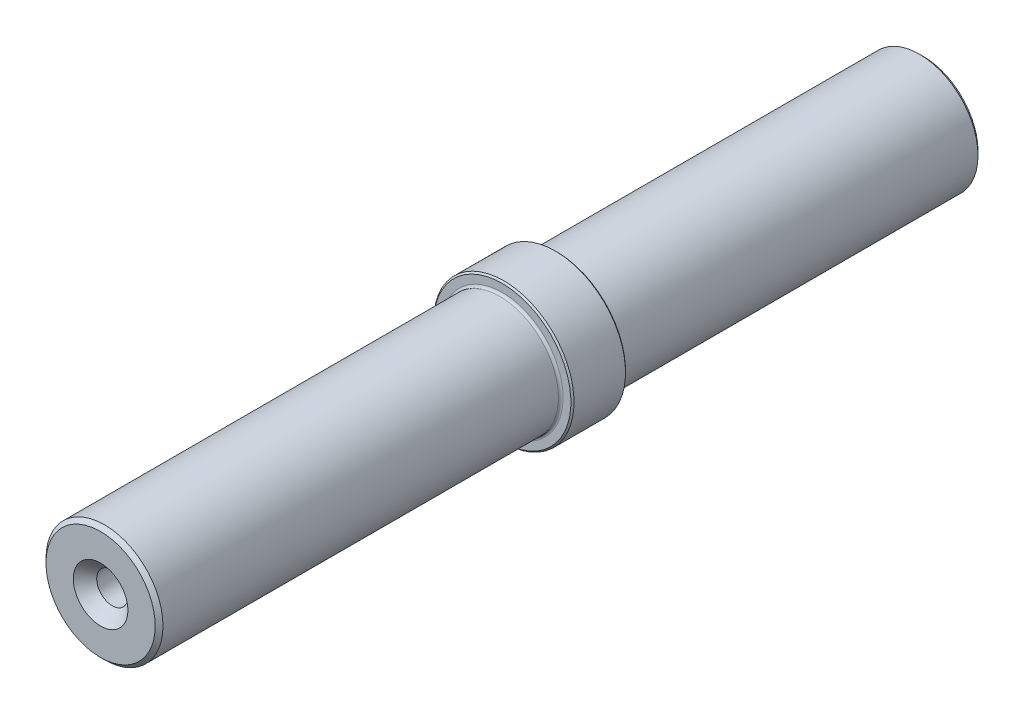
SolidWorks part; units mm, degrees
ref_plane "前视基准面" through (0, 0, 0) normal (0, 0, 1) x (1, 0, 0)
ref_plane "上视基准面" through (0, 0, 0) normal (0, 1, 0) x (1, 0, 0)
ref_plane "右视基准面" through (0, 0, 0) normal (1, 0, 0) x (0, 0, -1)
sketch "草图1" plane through (0, 0, 0) normal (0, 0, 1) x (1, 0, 0)
  circle A0 centre (0, 0) radius 7.5
  dimension "D1" = 15
extrude "凸台-拉伸1" add sketch "草图1" along normal blind 105.5
ref_plane "基准面1" through (7.5, 0, 0) normal (1, 0, 0) x (0, 0, -1)
ref_plane "基准面2" through (0, 0, 47) normal (0, 0, -1) x (-1, 0, 0)
sketch "草图3" plane through (0, 0, 47) normal (0, 0, -1) x (-1, 0, 0)
  circle A0 centre (0, 0) radius 9
  dimension "D1" = 18
extrude "凸台-拉伸3" add sketch "草图3" against normal blind 7
hole_wizard "M5 螺纹孔1" positions "草图6" profile "草图7" tap size "M5" standard "GB"
sketch "草图6" plane through (0, 0, 0) normal (0, 0, -1) x (-1, 0, 0)
  point P0 (0, 0)
sketch "草图7" plane through (0, 0, 0) normal (1, 0, 0) x (0, 1, 0)
  line L0 (0, 0) -> (0, 13.6618)
  line L1 (0, 13.6618) -> (2.1, 12.4)
  line L2 (2.1, 12.4) -> (2.1, 0.425)
  line L3 (2.1, 0.425) -> (2.525, 0)
  line L5 (2.525, 0) -> (0, 0)
  line L6 (-2.1, 0.425) -> (-2.525, 0) construction
  line L10 (0, 13.6618) -> (-2.1, 12.4) construction
  line L11 (0, -6.35) -> (0, 107.95) construction
  dimension "螺纹孔钻头直径" = 4.2
  dimension "螺纹孔钻头深度" = 12.4
  dimension "近端锥形沉头孔直径" = 5.05
  dimension "近端锥形沉头孔角度" = 90
  dimension "导头角度" = 118
hole_wizard "Ø4.0 (4) 直径孔1" positions "草图8" profile "草图10" hole size "Ø4.0" standard "GB"
sketch "草图8" plane through (0, 0, 105.5) normal (0, 0, 1) x (1, 0, 0)
  point P0 (0, 0)
sketch "草图10" plane through (0, 0, 105.5) normal (1, 0, 0) x (0, -1, 0)
  line L0 (0, 0) -> (0, 16.2017)
  line L1 (0, 16.2017) -> (2, 15)
  line L2 (2, 15) -> (2, 1.5)
  line L3 (2, 1.5) -> (3.5, 0)
  line L5 (3.5, 0) -> (0, 0)
  line L6 (-2, 1.5) -> (-3.5, 0) construction
  line L10 (0, 16.2017) -> (-2, 15) construction
  line L11 (0, -6.35) -> (0, 107.95) construction
  dimension "孔直径" = 4
  dimension "孔深度" = 15
  dimension "近端锥形沉头孔直径" = 7
  dimension "近端锥形沉头孔角度" = 90
  dimension "导头角度" = 118
chamfer "倒角1" [suppressed] distance 0.3 angle 45
ref_plane "基准面3" through (0, 0, 97) normal (0, 0, -1) x (-1, 0, 0)
chamfer "倒角2" distance 0.5 angle 45 2 edges at (7.5, 0, 105.5) (7.5, 0, 0)
fillet "圆角1" radius 0.3 2 edges at (-7.5, 0, 54) (-7.5, 0, 47)
ref_plane "基准面4" through (9, 0, 0) normal (1, 0, 0) x (0, 0, -1)
sketch "草图11" plane through (9, 0, 0) normal (1, 0, 0) x (0, 0, -1)
  line L0 (-54, 0) -> (-47, 0) construction
  line L1 (-33.5, 0) -> (-67.5, 0) construction
  line L2 (-33.5, -3) -> (-67.5, -3)
  line L3 (-33.5, 3) -> (-67.5, 3)
  line L4 (-50.5, -9) -> (-50.5, 13.9878) construction
  line L5 (-54, -9) -> (-47, -9) construction
  arc A0 (-33.5, -3) -> (-33.5, 3) centre (-33.5, 0) ccw
  arc A1 (-67.5, 3) -> (-67.5, -3) centre (-67.5, 0) ccw
  point P5 (-50.5, 0)
  dimension "D1" = 6
  dimension "D2" = 34
extrude "切除-拉伸1" [suppressed] cut sketch "草图11" against normal blind 3.5
chamfer "倒角3" distance 0.2 angle 45 2 edges at (-9, 0, 47) (-9, 0, 54)
other "冻结***"
